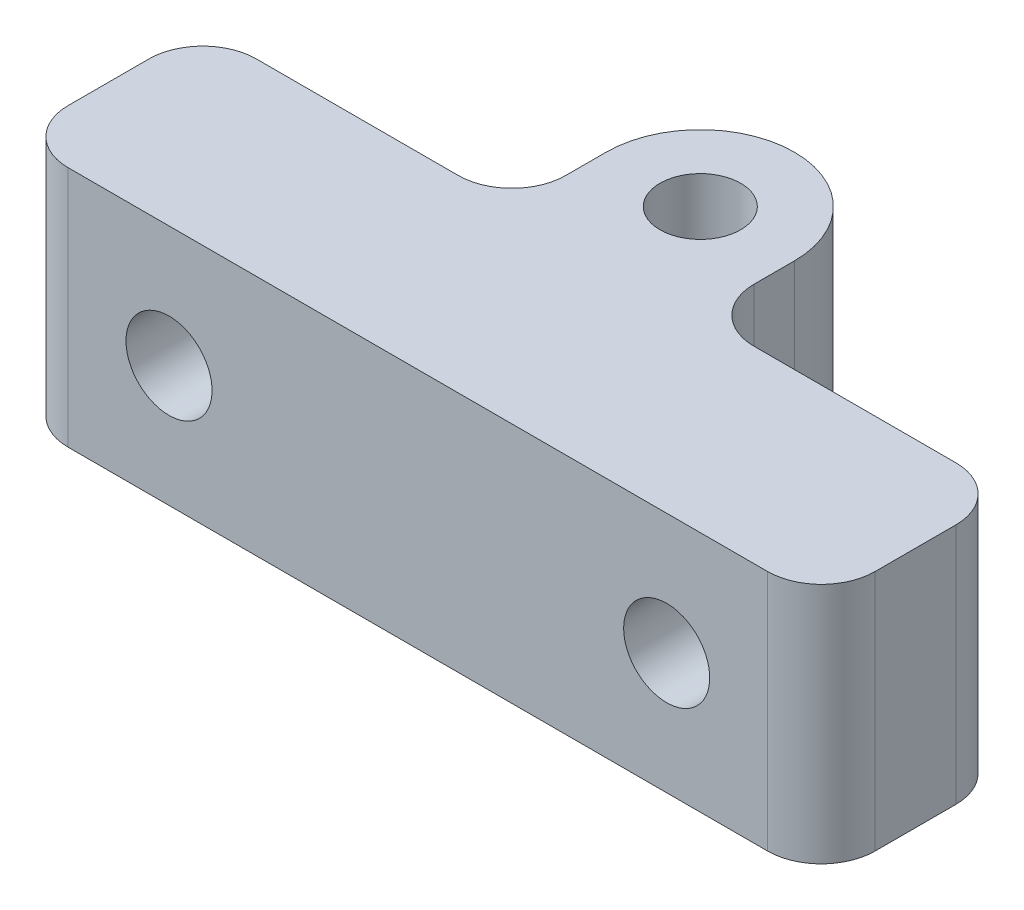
SolidWorks part; units mm, degrees
ref_plane "Front Plane" through (0, 0, 0) normal (0, 0, 1) x (1, 0, 0)
ref_plane "Top Plane" through (0, 0, 0) normal (0, 1, 0) x (1, 0, 0)
ref_plane "Right Plane" through (0, 0, 0) normal (1, 0, 0) x (0, 0, -1)
sketch "Sketch1" plane through (0, 0, 0) normal (0, 1, 0) x (1, 0, 0)
  line L0 (-0.1166, 0) -> (0, 0)
  line L1 (0, 0) -> (0, -10.5) construction
  line L2 (-15, -10.5) -> (15, -10.5)
  line L3 (-15, -10.5) -> (-15, -3.5)
  line L4 (-15, -3.5) -> (-3.5, -3.5)
  line L5 (15, -3.5) -> (15, -10.5)
  line L6 (15, -3.5) -> (3.5, -3.5)
  line L7 (-3.5, -3.5) -> (-3.5, 0)
  line L8 (3.5, -3.5) -> (3.5, 0)
  circle A0 centre (0, 0) radius 1.5
  arc A1 (3.5, 0) -> (-3.5, 0) centre (0, 0) ccw
  point P8 (0, -10.5)
  dimension "D1" = 3
  dimension "D5" = 7
  dimension "D2" = 10.5
  dimension "D3" = 30
  dimension "D4" = 7
extrude "Boss-Extrude1" add sketch "Sketch1" along normal blind 9
fillet "Fillet1" radius 2 6 edges at (-15, 4.5, 3.5) (15, 4.5, 3.5) (3.5, 4.5, 3.5) (-3.5, 4.5, 3.5) (15, 4.5, 10.5) (-15, 4.5, 10.5)
sketch "Sketch2" plane through (0, 0, 3.5) normal (0, 0, -1) x (-1, 0, 0)
  line L0 (-13, 0) -> (-5.5, 9) construction
  line L1 (5.5, 0) -> (13, 9) construction
  circle A0 centre (-9.25, 4.5) radius 1.6
  circle A1 centre (9.25, 4.5) radius 1.6
  dimension "D1" = 3.2
extrude "Cut-Extrude1" cut sketch "Sketch2" against normal through all
